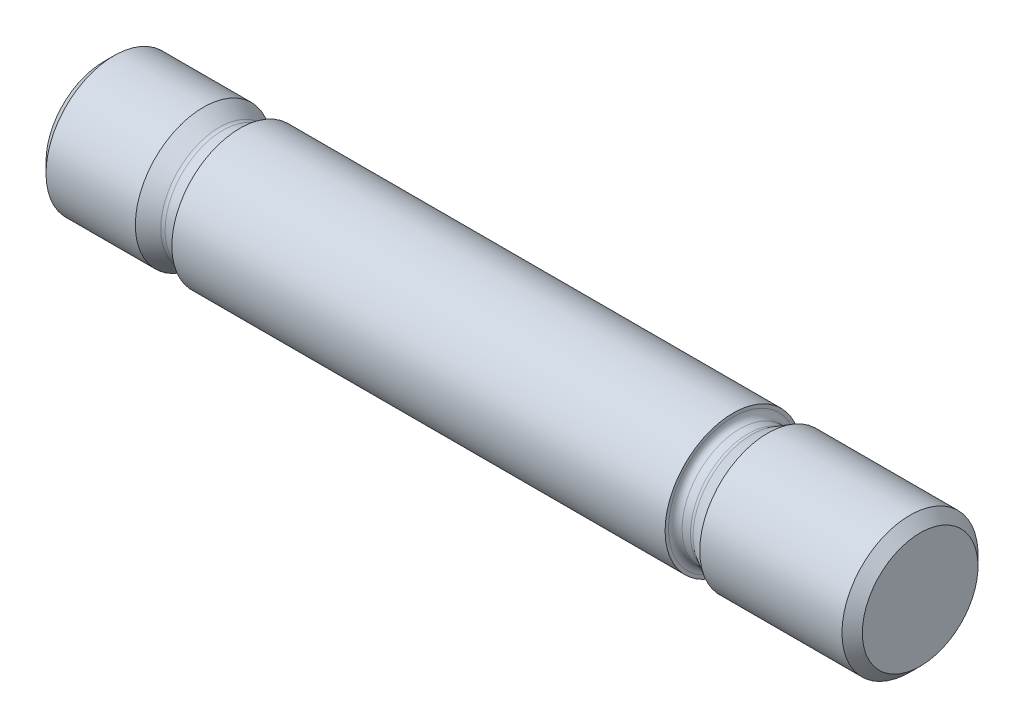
SolidWorks part; units mm, degrees
ref_plane "Plane1" through (0, 0, 0) normal (0, 0, 1) x (1, 0, 0)
ref_plane "Plane2" through (0, 0, 0) normal (0, 1, 0) x (1, 0, 0)
ref_plane "Plane3" through (0, 0, 0) normal (1, 0, 0) x (0, 0, -1)
sketch "BodySke" plane through (0, 0, 0) normal (0, 0, 1) x (1, 0, 0)
  line L0 (17, 8.634) -> (14.634, 10)
  line L1 (14.634, 10) -> (1.5, 10)
  line L2 (20, 10) -> (20, 9.5)
  line L3 (19, 8.5) -> (17.5, 8.5)
  line L5 (1.5, 10) -> (0, 8.5)
  line L7 (92.5019, 10) -> (92.5019, 9.5)
  line L8 (93.5019, 8.5) -> (94.734, 8.5)
  line L9 (95.234, 8.634) -> (97.6, 10)
  line L10 (97.6, 10) -> (118.5, 10)
  line L11 (118.5, 10) -> (120, 8.5)
  line L12 (120, 8.5) -> (120, 0)
  line L13 (120, 0) -> (0, 0)
  line L14 (-3.175, 0) -> (101.6, 0) construction
  line L15 (99.7895, -8.5) -> (120, -8.5) construction
  line L16 (92.5019, -8.5) -> (95.0019, -8.5) construction
  line L17 (11.034, -10) -> (92.5019, -10) construction
  line L18 (0, 8.5) -> (0, 0)
  line L19 (20, 10) -> (92.5019, 10)
  line L20 (97.0019, 13.3514) -> (97.0019, -4.0014) construction
  line L21 (97.6, 12.2761) -> (97.6, -3.5735) construction
  arc A0 (17.5, 8.5) -> (17, 8.634) centre (17.5, 9.5) cw
  arc A1 (20, 9.5) -> (19, 8.5) centre (19, 9.5) cw
  arc A2 (94.734, 8.5) -> (95.234, 8.634) centre (94.734, 9.5) ccw
  arc A3 (92.5019, 9.5) -> (93.5019, 8.5) centre (93.5019, 9.5) ccw
  point P26 (95.0019, 8.5)
  point P29 (92.5019, 8.5)
  dimension "Length" = 100
  dimension "Thread_neck_width" = 2.5
  dimension "Shoulder_neck_width" = 2.5
  dimension "Advance" = 2
  dimension "Thread_nom" = 22.4
  dimension "Thread_lim" = 22.9981
  dimension "Studend_length" = 20
  dimension "Thread_len" = 22.4
revolve "BaseBody" add sketch "BodySke" angle 360 about L14
sketch "ThdSchSke" plane through (0, 0, 0) normal (0, 0, 1) x (1, 0, 0)
  line L0 (97.6, -8.5) -> (96.5497, -10)
  line L1 (97.6, -8.5) -> (98.6503, -10)
  line L2 (98.6503, -10) -> (98.6503, -12.5)
  line L3 (-3.175, 0) -> (5.1513, 0) construction
  line L4 (120, -8.5) -> (120, 8.5) construction
  line L5 (98.6503, -12.5) -> (96.5497, -12.5)
  line L6 (96.5497, -12.5) -> (96.5497, -10)
  dimension "Thread_minor" = 17
  dimension "Diameter" = 20
  dimension "Start" = 22.4
  dimension "SideAngle" = 55
  dimension "VeeAngle" = 70
  dimension "Overcut" = 25
revolve "ThreadSchematic" [suppressed] cut sketch "ThdSchSke" angle 360 about L3
pattern_linear "ThdSchPat" [suppressed]
sketch "ThdSchSketStud" plane through (0, 0, 0) normal (0, 0, 1) x (1, 0, 0)
  line L0 (15.5, -8.5) -> (14.4497, -10)
  line L1 (15.5, -8.5) -> (16.5503, -10)
  line L2 (16.5503, -10) -> (16.5503, -12.5)
  line L3 (-3.175, 0) -> (5.1513, 0) construction
  line L5 (16.5503, -12.5) -> (14.4497, -12.5)
  line L6 (14.4497, -12.5) -> (14.4497, -10)
  line L7 (0, 8.5) -> (0, -8.5) construction
  dimension "Thread_minor" = 17
  dimension "Diameter" = 20
  dimension "SideAngle" = 55
  dimension "VeeAngle" = 70
  dimension "Overcut" = 25
  dimension "Start_" = 15.5
revolve "ThreadSchematicStud" [suppressed] cut sketch "ThdSchSketStud" angle 360 about L3
pattern_linear "ThdSchPatStud" [suppressed]
equation "\"Thread_minor@ThreadCosmetic\" = \"Minor_dia@BodySke\""
equation "\"Thrd_minor@ThreadCosmeticStud\" = \"Thread_minor@ThreadCosmetic\""
equation "\"Thread_len@BodySke\" = \"Thread_nom@BodySke\""
equation "\"Thread_minor@ThdSchSke\" = \"Minor_dia@BodySke\""
equation "\"Diameter@ThdSchSke\" = \"Thread_dia@BodySke\""
equation "\"Overcut@ThdSchSke\" = \"Thread_dia@BodySke\" * 1.25"
equation "\"Start@ThdSchSke\" = \"Thread_nom@BodySke\"  '   - \"Advance@BodySke\""
equation "\"Num_threads@ThdSchPat\" = int( \"Thread_len@BodySke\" / \"Advance@BodySke\" + 0.999 ) + 1"
equation "\"Advance@ThdSchPat\" = \"Thread_nom@BodySke\" /  ( \"Num_threads@ThdSchPat\" - 1 ) 'relax it"
equation "\"Num_threads@ThdSchPat\" = \"Num_threads@ThdSchPat\" - sgn( \"Num_threads@ThdSchPat\" - 1 ) '---chamfered tips only---"
equation "\"Diameter@ThdSchSketStud\" = \"Diameter@ThdSchSke\""
equation "\"Thread_minor@ThdSchSketStud\" = \"Thread_minor@ThdSchSke\""
equation "\"Overcut@ThdSchSketStud\" = \"Overcut@ThdSchSke\""
equation "\"Start_@ThdSchSketStud\" = \"Studend_length@BodySke\" - \"Shoulder_neck_width@BodySke\" - \"Advance@BodySke\""
equation "\"Num_threads@ThdSchPatStud\" = int( \"Start_@ThdSchSketStud\"/ \"Advance@BodySke\" + 0.999 )  + 1"
equation "\"Advance@ThdSchPatStud\" = \"Start_@ThdSchSketStud\" /  ( \"Num_threads@ThdSchPatStud\" - 1 ) 'relax it"
